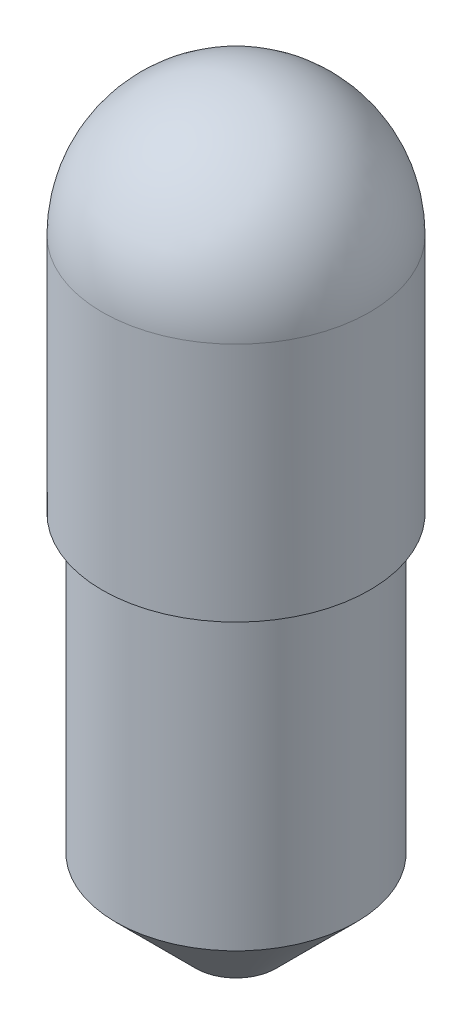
SolidWorks part; units mm, degrees
ref_plane "Plan de face" through (0, 0, 0) normal (0, 0, 1) x (1, 0, 0)
ref_plane "Plan de dessus" through (0, 0, 0) normal (0, 1, 0) x (1, 0, 0)
ref_plane "Plan de droite" through (0, 0, 0) normal (1, 0, 0) x (0, 0, -1)
sketch "Esquisse1" plane through (0, 0, 0) normal (0, 0, 1) x (1, 0, 0)
  line L0 (0, 45.3519) -> (0, -42.9223) construction
  line L1 (0, 0) -> (-1.5, 0)
  line L2 (-1.5, 0) -> (-4.5, 3)
  line L3 (-4.5, 3) -> (-4.5, 14)
  line L4 (-5, 14) -> (-4.5, 14)
  line L5 (-5, 14) -> (-5, 23)
  line L7 (0, 0) -> (0, 28)
  arc A0 (-5, 23) -> (0, 28) centre (0, 23) cw
  dimension "D7" = 5
  dimension "D1" = 1.5
  dimension "D2" = 4.5
  dimension "D3" = 3
  dimension "D4" = 9
  dimension "D5" = 10
  dimension "D6" = 11
  dimension "D8" = 0.5
revolve "Révolution4" add sketch "Esquisse1" angle 360 about L0
